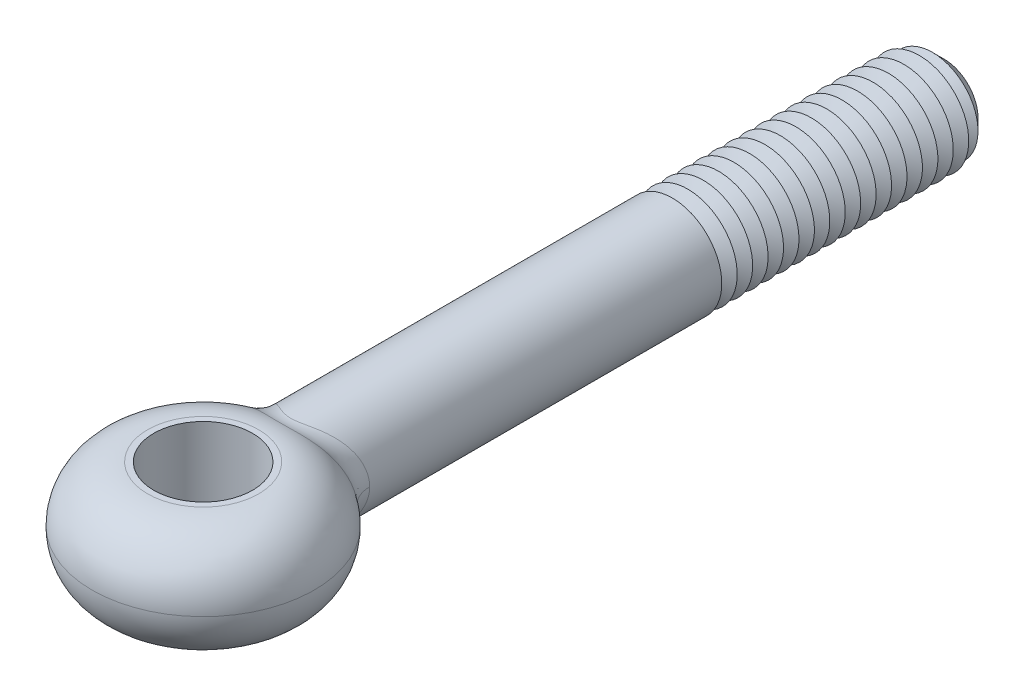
SolidWorks part; units mm, degrees
ref_plane "Front Plane" through (0, 0, 0) normal (0, 0, 1) x (1, 0, 0)
ref_plane "Top Plane" through (0, 0, 0) normal (0, 1, 0) x (1, 0, 0)
ref_plane "Right Plane" through (0, 0, 0) normal (1, 0, 0) x (0, 0, -1)
sketch "Sketch7" plane through (0, 0, 0) normal (0, 1, 0) x (1, 0, 0)
  circle A0 centre (0, 0) radius 9
  dimension "D1" = 18
extrude "Boss-Extrude3" add sketch "Sketch7" along normal mid plane 9
sketch "Sketch8" plane through (0, 0, 0) normal (0, 0, 1) x (1, 0, 0)
  circle A0 centre (0, 0) radius 4
  dimension "D1" = 8
extrude "Boss-Extrude4" add sketch "Sketch8" against normal blind 60
fillet "Fillet5" radius 4.5 2 edges at (0, -4.5, 9) (0, 4.5, 9)
fillet "Fillet6" radius 2.5 2 edges at (0.3214, -3.9871, -6.5786) (-0.3214, 3.9871, -6.5786)
chamfer "Chamfer1" distance 1.25 angle 45 1 edges at (4, 0, -60)
sketch "Sketch10" plane through (0, 0, 0) normal (0, 1, 0) x (1, 0, 0)
  line L0 (0, 28.1405) -> (0, -7.9233) construction
sketch "Sketch11" plane through (0, 0, 0) normal (0, 1, 0) x (1, 0, 0)
  line L0 (-4, 38) -> (-2.9175, 38.625)
  line L1 (-4, 58.75) -> (-4, 9.4868) construction
  line L2 (-2.9175, 38.625) -> (-4, 39.25)
  line L3 (-4, 39.25) -> (-4, 38)
  line L4 (2.75, 60) -> (-2.75, 60) construction
  dimension "D1" = 1.25
  dimension "D2" = 22
revolve "Cut-Revolve1" cut sketch "Sketch11" angle 360 about L0
pattern_linear "LPattern1" count 17 spacing 1.25 along (0, 0, -1) of "Cut-Revolve1"
sketch "Sketch12" plane through (0, 0, 0) normal (0, 1, 0) x (1, 0, 0)
  circle A0 centre (0, 0) radius 4
  dimension "D1" = 8
extrude "Cut-Extrude1" cut sketch "Sketch12" against normal mid plane 9
